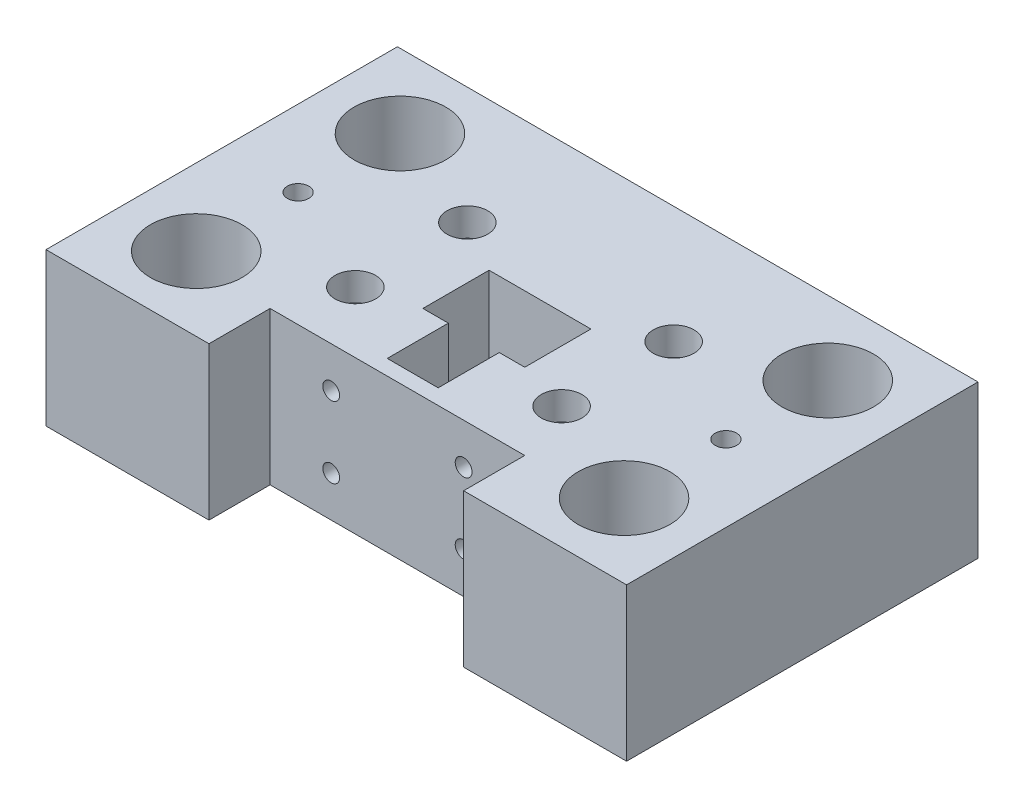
SolidWorks part; units mm, degrees
ref_plane "前视基准面" through (0, 0, 0) normal (0, 0, 1) x (1, 0, 0)
ref_plane "上视基准面" through (0, 0, 0) normal (0, 1, 0) x (1, 0, 0)
ref_plane "右视基准面" through (0, 0, 0) normal (1, 0, 0) x (0, 0, -1)
sketch "草图1" plane through (0, 0, 0) normal (0, 0, 1) x (1, 0, 0)
  line L0 (0, 30) -> (114, 30)
  line L1 (0, 0) -> (114, 0)
  line L2 (0, 0) -> (0, 30)
  line L3 (114, 0) -> (114, 30)
extrude "凸台-拉伸1" add sketch "草图1" along normal blind 69
sketch "草图2" plane through (0, 30, 0) normal (0, 1, 0) x (1, 0, 0)
  line L0 (0, -69) -> (32, -69)
  line L1 (0, 0) -> (114, 0)
  line L2 (0, -69) -> (0, 0)
  line L3 (114, -69) -> (114, 0)
  line L4 (47, -42) -> (52, -42)
  line L5 (47, -29) -> (67, -29)
  line L6 (52, -52) -> (52, -42)
  line L7 (62, -52) -> (62, -42)
  line L8 (47, -42) -> (47, -29)
  line L9 (67, -42) -> (67, -29)
  line L10 (62, -42) -> (67, -42)
  line L11 (52, -52) -> (62, -52)
  line L12 (32, -69) -> (32, -57)
  line L13 (82, -69) -> (82, -57)
  line L14 (32, -57) -> (82, -57)
  line L15 (82, -69) -> (114, -69)
  circle A0 centre (15, -14.5) radius 9
  circle A1 centre (99, -14.5) radius 9
  circle A2 centre (99, -54.5) radius 9
  circle A3 centre (15, -54.5) radius 9
  circle A4 centre (36.75, -45.012) radius 2.5
  circle A5 centre (77.25, -45.012) radius 2.5
  circle A6 centre (77.25, -23.012) radius 2.5
  circle A7 centre (36.75, -23.012) radius 2.5
extrude "切除-拉伸1" cut sketch "草图2" against normal blind 69 flip side to cut
sketch "草图3" plane through (0, 30, 0) normal (0, 1, 0) x (1, 0, 0)
  line L0 (52, -54) -> (62, -54)
  line L1 (52, -52) -> (62, -52)
  line L2 (52, -52) -> (52, -54)
  line L3 (62, -52) -> (62, -54)
extrude "切除-拉伸2" cut sketch "草图3" against normal blind 25
sketch "草图4" plane through (0, 30, 0) normal (0, 1, 0) x (1, 0, 0)
  circle A0 centre (36.75, -45.012) radius 4
  circle A1 centre (77.25, -45.012) radius 4
  circle A2 centre (77.25, -23.012) radius 4
  circle A3 centre (36.75, -23.012) radius 4
extrude "切除-拉伸3" cut sketch "草图4" against normal blind 5.5
sketch "草图5" plane through (0, 30, 0) normal (0, 1, 0) x (1, 0, 0)
  circle A0 centre (15, -34.5) radius 2.1
  circle A1 centre (99, -34.5) radius 2.1
extrude "切除-拉伸4" cut sketch "草图5" against normal blind 15
sketch "草图6" plane through (0, 30, 0) normal (0, 1, 0) x (1, 0, 0)
  circle A0 centre (42, -35.5) radius 1.65 construction
  circle A1 centre (72, -35.5) radius 1.65 construction
sketch "草图7" plane through (0, 0, 0) normal (0, -1, 0) x (1, 0, 0)
  circle A0 centre (42, 35.5) radius 1.65
  circle A1 centre (72, 35.5) radius 1.65
extrude "切除-拉伸5" cut sketch "草图7" against normal blind 15
sketch "草图8" plane through (0, 0, 57) normal (0, 0, 1) x (1, 0, 0)
  circle A0 centre (44, 22) radius 1.65
  circle A1 centre (70, 22) radius 1.65
  circle A2 centre (70, 8) radius 1.65
  circle A3 centre (44, 8) radius 1.65
extrude "切除-拉伸6" cut sketch "草图8" against normal blind 15
